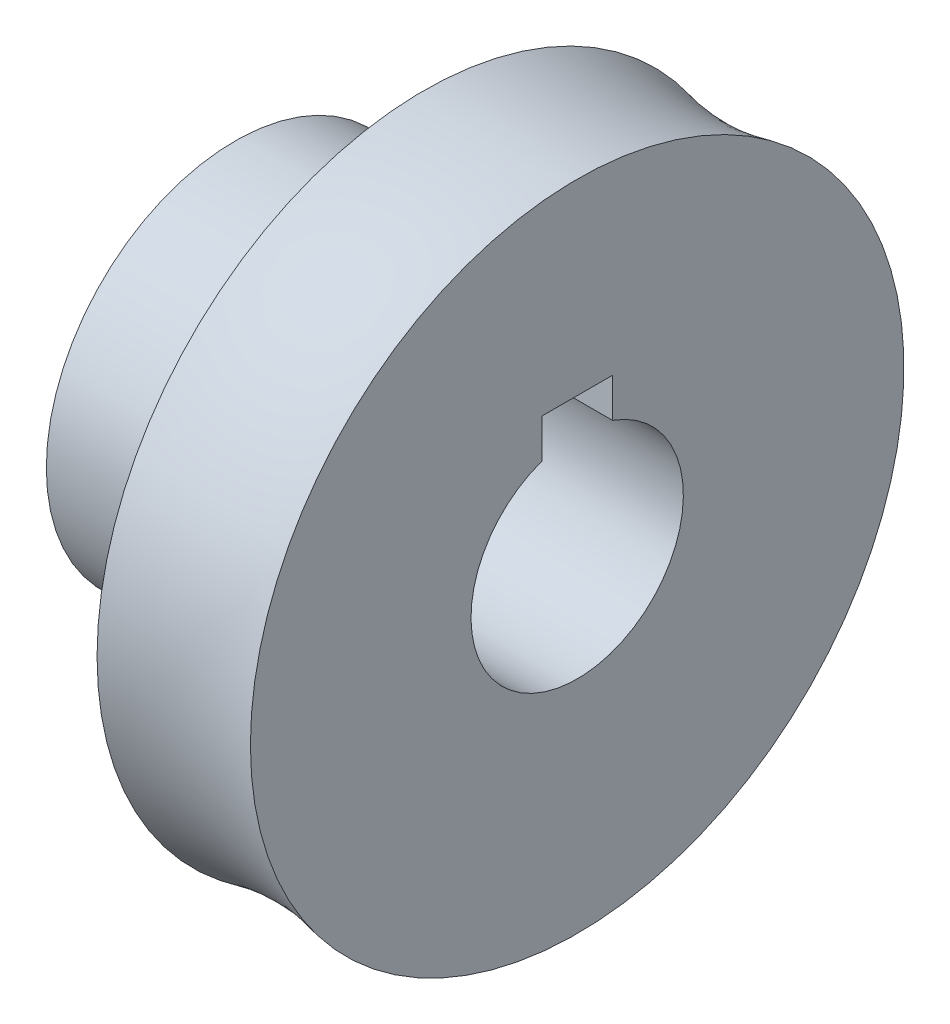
SolidWorks part; units mm, degrees
ref_plane "Face" through (0, 0, 0) normal (0, 0, 1) x (1, 0, 0)
ref_plane "Dessus" through (0, 0, 0) normal (0, 1, 0) x (1, 0, 0)
ref_plane "Droite" through (0, 0, 0) normal (1, 0, 0) x (0, 0, -1)
sketch "Esquisse1" plane through (0, 0, 0) normal (0, 0, 1) x (1, 0, 0)
  line L0 (0, 0) -> (56.3912, 0) construction
  line L1 (0, 4.5) -> (14.5, 4.5)
  line L2 (14.5, 4.5) -> (14.5, 13.85)
  line L3 (0, 4.5) -> (0, 8)
  line L4 (0, 8) -> (8, 8)
  line L5 (8, 8) -> (8, 13.85)
  arc A0 (8, 13.85) -> (14.5, 13.85) centre (11.25, 27.4675) ccw
  dimension "D5" = 14
  dimension "D1" = 14.5
  dimension "D2" = 9
  dimension "D3" = 16
  dimension "D4" = 27.7
revolve "Révolution1" add sketch "Esquisse1" angle 360 about L0
sketch "Esquisse2" plane through (14.5, 0, 0) normal (1, 0, 0) x (0, 0, -1)
  line L0 (0, 15.1601) -> (0, -15.0805) construction
  line L1 (16.9706, 0) -> (-15.8564, 0) construction
  line L3 (-1.5, 5.9) -> (1.5, 5.9)
  line L4 (-1.5, 5.9) -> (-1.5, 0)
  line L5 (-1.5, 0) -> (1.5, 0)
  line L6 (1.5, 5.9) -> (1.5, 0)
  circle A0 centre (0, 0) radius 4.5 construction
  dimension "D1" = 1.4
  dimension "D2" = 3
extrude "Enlèv. mat.-Extru.1" cut sketch "Esquisse2" against normal through all
